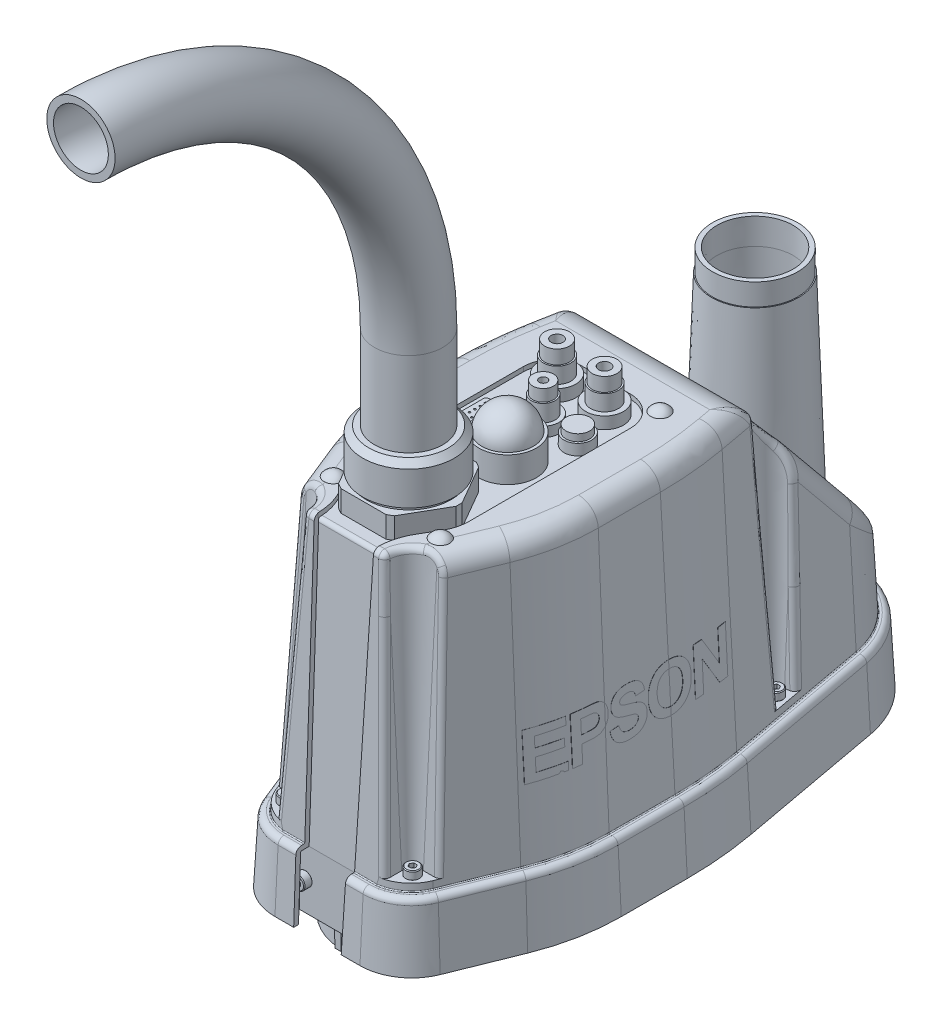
SolidWorks part; units mm, degrees
ref_plane "Front Plane" through (0, 0, 0) normal (0, 0, 1) x (1, 0, 0)
ref_plane "Top Plane" through (0, 0, 0) normal (0, 1, 0) x (1, 0, 0)
ref_plane "Right Plane" through (0, 0, 0) normal (1, 0, 0) x (0, 0, -1)
imported_body "Imported1"
ref_plane "Robot Z S" through (0, 144.5, 0) normal (0, -1, 0) x (1, 0, 0)
ref_plane "Plane1" through (36.8129, 0, 0) normal (1, 0, 0) x (0, 0, -1)
surface "Surface-Offset1" parameters "D1"=0.05
sketch "Sketch1"
extrude "Extrude1" add sketch "Sketch1" along normal up to surface (19.5594 mm away) separate body
ref_plane "Plane2" through (-36.8129, 0, 0) normal (1, 0, 0) x (0, 0, -1)
surface "Surface-Offset2" parameters "D1"=0.05
sketch "Sketch2"
extrude "Extrude2" add sketch "Sketch2" against normal up to surface (19.4072 mm away) separate body
